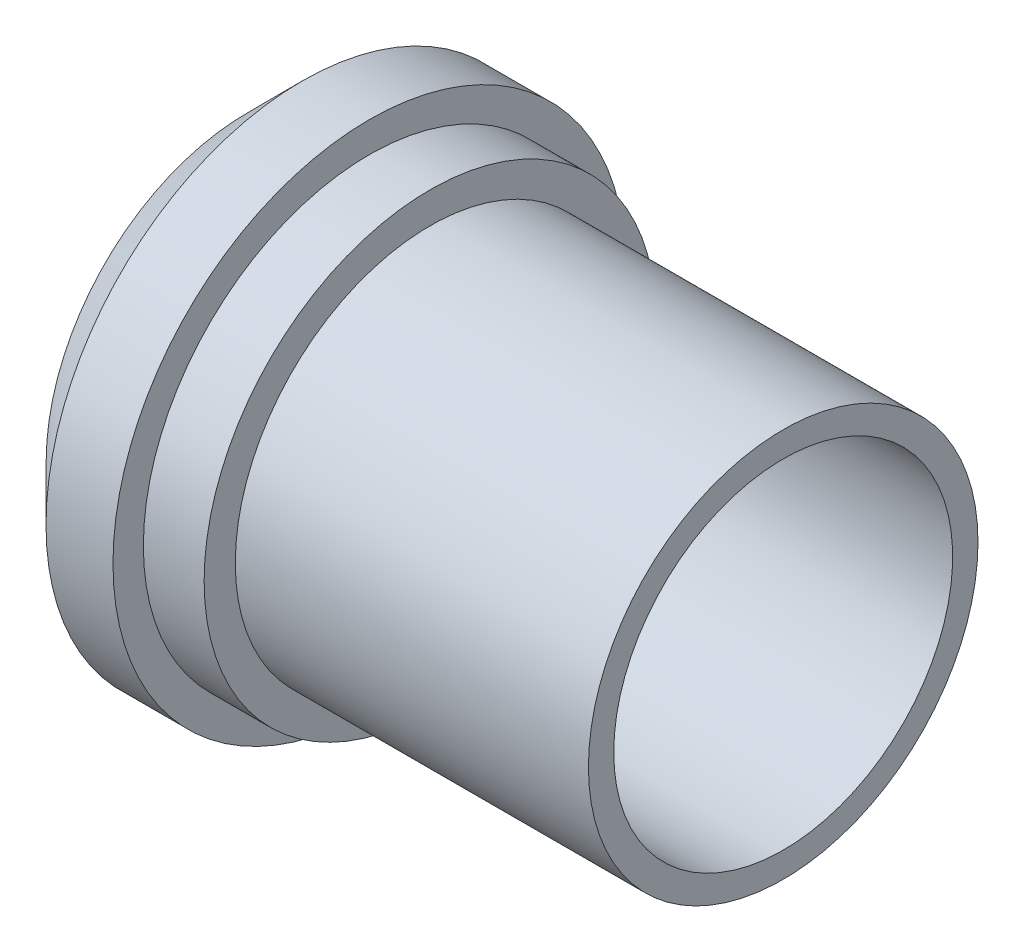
SolidWorks part; units mm, degrees
ref_plane "Front Plane" through (0, 0, 0) normal (0, 0, 1) x (1, 0, 0)
ref_plane "Top Plane" through (0, 0, 0) normal (0, 1, 0) x (1, 0, 0)
ref_plane "Right Plane" through (0, 0, 0) normal (1, 0, 0) x (0, 0, -1)
sketch "Sketch1" plane through (0, 0, 0) normal (0, 0, 1) x (1, 0, 0)
  line L0 (0, 0) -> (-23.0251, 0)
  line L1 (-23.0251, 0) -> (-23.0251, -2.032)
  line L2 (-23.0251, -2.032) -> (-26.9875, -2.032)
  line L3 (-26.9875, -2.032) -> (-26.9875, -4.0132)
  line L4 (-26.9875, -4.0132) -> (-31.3538, -4.0132)
  line L5 (-31.3538, -4.0132) -> (-34.925, -0.4318)
  line L6 (-34.925, -0.4318) -> (-34.925, 12.7)
  line L7 (-34.925, 12.7) -> (0, 12.7)
  line L8 (0, 12.7) -> (0, 0)
  dimension "D1" = 12.7
  dimension "D2" = 34.925
  dimension "D3" = 3.9624
  dimension "D4" = 4.3663
  dimension "D5" = 3.5712
  dimension "D6" = 13.1318
  dimension "D7" = 16.7132
  dimension "D8" = 14.732
revolve "Revolve1" add sketch "Sketch1" angle 360 about L7
sketch "Sketch4" plane through (-34.925, 0, 0) normal (-1, 0, 0) x (0, 0, 1)
  circle A0 centre (0, 12.7) radius 11.049
extrude "Cut-Extrude1" cut sketch "Sketch4" against normal blind 34.925 contours A0
